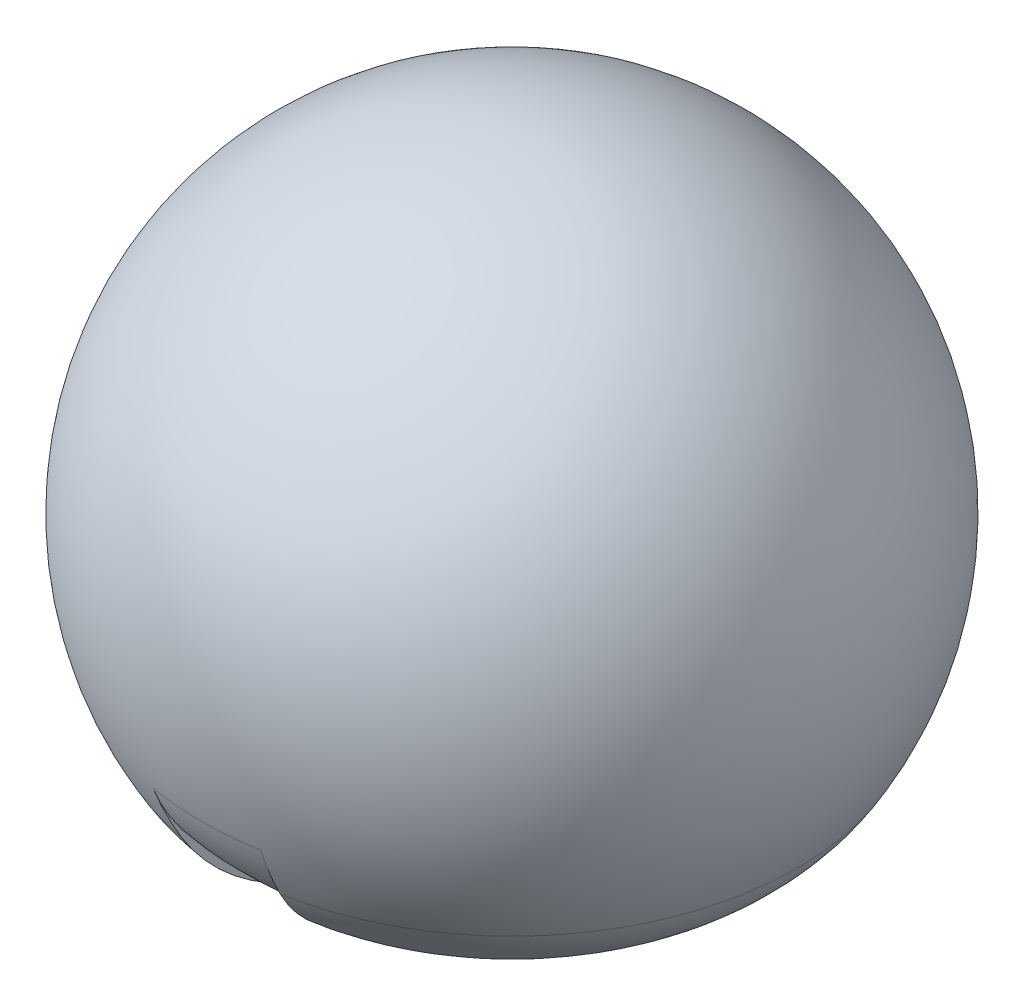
SolidWorks part; units mm, degrees
ref_plane "前视基准面" through (0, 0, 0) normal (0, 0, 1) x (1, 0, 0)
ref_plane "上视基准面" through (0, 0, 0) normal (0, 1, 0) x (1, 0, 0)
ref_plane "右视基准面" through (0, 0, 0) normal (1, 0, 0) x (0, 0, -1)
sketch "草图1" plane through (0, 0, 0) normal (1, 0, 0) x (0, 0, -1)
  line L0 (0, 1.4018) -> (0, 170.7592) construction
  line L1 (0, 489.2408) -> (0, 590) construction
  line L2 (0, 590) -> (-20.9486, 591.4688) construction
  line L3 (-20.9486, 591.4688) -> (0, 890.2353) construction
  line L4 (0, 890.2353) -> (0, 590) construction
  line L5 (0, 330) -> (485.178, 49.8823) construction
  line L6 (0, -232.3545) -> (0, 1184.1534) construction
  line L7 (225.1666, 200) -> (-74.8838, 189.4652) construction
  line L10 (225.1666, 200) -> (224.4337, 179.0128) construction
  line L11 (224.4337, 179.0128) -> (-74.8838, 189.4652) construction
  line L16 (0, 890.2353) -> (0, 489.2408)
  line L19 (0, 170.7592) -> (0, 1.4018)
  arc A0 (485.178, 49.8823) -> (0, 890.2353) centre (0, 330) ccw
  arc A1 (0, 70) -> (0, 590) centre (0, 330) ccw construction
  arc A2 (0, 170.7592) -> (0, 489.2408) centre (0, 330) ccw
  arc A7 (0, 1.4018) -> (485.178, 49.8823) centre (225.1666, 200) ccw
  dimension "D2" = 260
  dimension "D3" = 299.5
  dimension "D4" = 21
  dimension "D5" = 120
  dimension "D7" = 152
revolve "旋转1" add sketch "草图1" angle 170 about L6
sketch "草图2" plane through (0, 0, 0) normal (1, 0, 0) x (0, 0, -1)
  line L0 (0, 1.4018) -> (0, 170.7592) construction
  line L1 (0, 489.2408) -> (0, 590) construction
  line L2 (0, 590) -> (-20.9486, 591.4688) construction
  line L3 (-20.9486, 591.4688) -> (0, 890.2353) construction
  line L4 (0, 890.2353) -> (0, 590) construction
  line L5 (-296.0097, 222.2613) -> (-526.449, 138.3882) construction
  line L6 (0, -192.3918) -> (0, 1142.376) construction
  line L10 (225.1666, 200) -> (224.4337, 179.0128) construction
  line L11 (224.4337, 179.0128) -> (211.9765, 179.4478) construction
  line L16 (0, 1.4018) -> (0, 170.7592)
  line L19 (0, 489.2408) -> (0, 890.2353)
  arc A0 (0, 890.2353) -> (-526.449, 138.3882) centre (0, 330) ccw
  arc A1 (211.9765, 179.4478) -> (225.1666, 200) centre (0, 330) ccw construction
  arc A2 (-74.8838, 189.4652) -> (0, 170.7592) centre (0, 330) ccw
  arc A3 (-74.8838, 189.4652) -> (0, 1.4018) centre (225.1666, 200) ccw
  arc A4 (-59.5215, 477.6984) -> (-233.7853, 541.1252) centre (-244.3201, 241.0748) ccw
  arc A5 (-526.449, 138.3882) -> (-43.3812, 17.9944) centre (-244.3201, 241.0748) ccw
  arc A6 (-233.7853, 541.1252) -> (-43.3812, 17.9944) centre (0, 330) ccw
  arc A7 (0, 489.2408) -> (-59.5215, 477.6984) centre (0, 330) ccw
  arc A8 (0, 590) -> (-165.2671, 530.7157) centre (0, 330) ccw construction
  dimension "D2" = 260
  dimension "D3" = 299.5
  dimension "D4" = 21
revolve "旋转2" add sketch "草图2" angle 170 about L6
